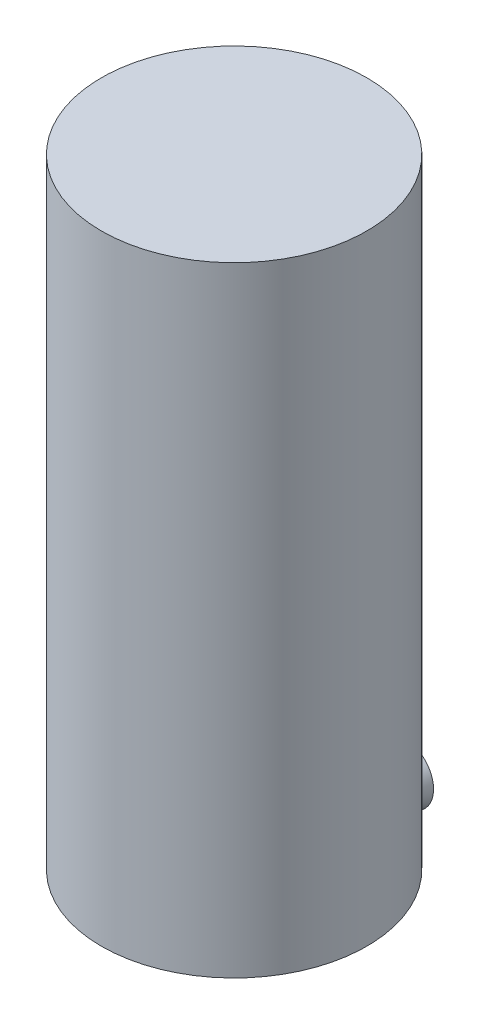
SolidWorks part; units mm, degrees
ref_plane "Front Plane" through (0, 0, 0) normal (0, 0, 1) x (1, 0, 0)
ref_plane "Top Plane" through (0, 0, 0) normal (0, 1, 0) x (1, 0, 0)
ref_plane "Right Plane" through (0, 0, 0) normal (1, 0, 0) x (0, 0, -1)
sketch "Sketch1" plane through (0, 0, 0) normal (0, 1, 0) x (1, 0, 0)
  circle A0 centre (0, 0) radius 38.1
  dimension "D1" = 76.2
extrude "Extrude1" add sketch "Sketch1" along normal blind 177.8
sketch "Sketch4" plane through (0, 0, 0) normal (0, -1, 0) x (1, 0, 0)
  circle A0 centre (0, 0) radius 38.1
sketch "Sketch5" plane through (0, 0, 0) normal (1, 0, 0) x (0, 0, -1)
  line L0 (33.1, 0) -> (48.621, 0) construction
  line L1 (-38.1, 0) -> (38.1, 0) construction
  line L2 (48.621, 0) -> (48.621, 8.6278)
  line L3 (48.621, 8.6278) -> (37.4432, 4.6646)
  line L4 (48.621, 0) -> (34.148, 0)
  arc A0 (37.4432, 4.6646) -> (34.148, 0) centre (39.0971, 0) ccw
revolve "Revolve1" add sketch "Sketch5" angle 360 about L0
sketch "Sketch7" plane through (0, 0, 0) normal (0, -1, 0) x (1, 0, 0)
  circle A0 centre (0, 0) radius 38.1
curve "Helix/Spiral2"
